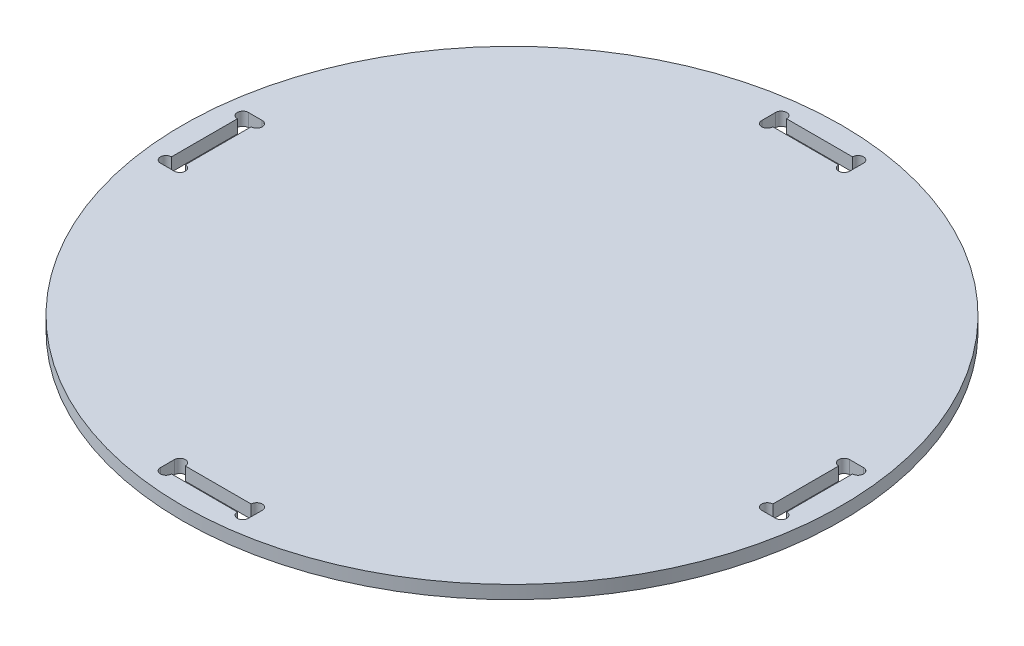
SolidWorks part; units mm, degrees
ref_plane "Front" through (0, 0, 0) normal (0, 0, 1) x (1, 0, 0)
ref_plane "Top" through (0, 0, 0) normal (0, 1, 0) x (1, 0, 0)
ref_plane "Right" through (0, 0, 0) normal (1, 0, 0) x (0, 0, -1)
sketch "Sketch1" plane through (0, 0, 0) normal (0, 1, 0) x (1, 0, 0)
  circle A0 centre (0, 0) radius 300
  dimension "D1" = 600
extrude "Boss-Extrude2" add sketch "Sketch1" along normal blind 12 contours A0
sketch "Sketch3" plane through (0, 12, 0) normal (0, 1, 0) x (1, 0, 0)
  line L0 (0, 300) -> (0, -300) construction
  line L1 (-300, 0) -> (300, 0) construction
  line L2 (-30, 280) -> (30, 280)
  line L3 (-30, 273.7) -> (30, 273.7) construction
  line L4 (-30, 267.4) -> (30, 267.4)
  line L5 (-39.9996, 280) -> (-39.9996, 267.4)
  line L6 (39.9996, 280) -> (39.9996, 267.4)
  line L7 (280, 39.9996) -> (267.4, 39.9996)
  line L8 (280, 30) -> (280, -30)
  line L9 (267.4, 30) -> (267.4, -30)
  line L10 (280, -39.9996) -> (267.4, -39.9996)
  line L11 (39.9996, -280) -> (39.9996, -267.4)
  line L12 (30, -280) -> (-30, -280)
  line L13 (30, -267.4) -> (-30, -267.4)
  line L14 (-39.9996, -280) -> (-39.9996, -267.4)
  line L15 (-280, -39.9996) -> (-267.4, -39.9996)
  line L16 (-280, -30) -> (-280, 30)
  line L17 (-267.4, -30) -> (-267.4, 30)
  line L18 (-280, 39.9996) -> (-267.4, 39.9996)
  circle A0 centre (0, 0) radius 300 construction
  arc A1 (280, 30) -> (280, 39.9996) centre (280.044, 34.9998) ccw
  arc A2 (-30, 280) -> (-39.9996, 280) centre (-34.9998, 280.044) ccw
  arc A3 (-30, 267.4) -> (-39.9996, 267.4) centre (-34.9998, 267.356) cw
  arc A4 (30, 267.4) -> (39.9996, 267.4) centre (34.9998, 267.356) ccw
  arc A7 (30, 280) -> (39.9996, 280) centre (34.9998, 280.044) cw
  arc A8 (267.4, 30) -> (267.4, 39.9996) centre (267.356, 34.9998) cw
  arc A9 (280, -30) -> (280, -39.9996) centre (280.044, -34.9998) cw
  arc A10 (267.4, -30) -> (267.4, -39.9996) centre (267.356, -34.9998) ccw
  arc A11 (30, -280) -> (39.9996, -280) centre (34.9998, -280.044) ccw
  arc A12 (30, -267.4) -> (39.9996, -267.4) centre (34.9998, -267.356) cw
  arc A13 (-30, -280) -> (-39.9996, -280) centre (-34.9998, -280.044) cw
  arc A14 (-30, -267.4) -> (-39.9996, -267.4) centre (-34.9998, -267.356) ccw
  arc A15 (-280, -30) -> (-280, -39.9996) centre (-280.044, -34.9998) ccw
  arc A16 (-267.4, -30) -> (-267.4, -39.9996) centre (-267.356, -34.9998) cw
  arc A17 (-280, 30) -> (-280, 39.9996) centre (-280.044, 34.9998) cw
  arc A18 (-267.4, 30) -> (-267.4, 39.9996) centre (-267.356, 34.9998) ccw
  point P12 (0, 280)
  point P64 (0, 0)
  dimension "D4" = 5
  dimension "D1" = 60
  dimension "D3" = 6.3
  dimension "D5" = 4
extrude "Cut-Extrude1" cut sketch "Sketch3" against normal through all
